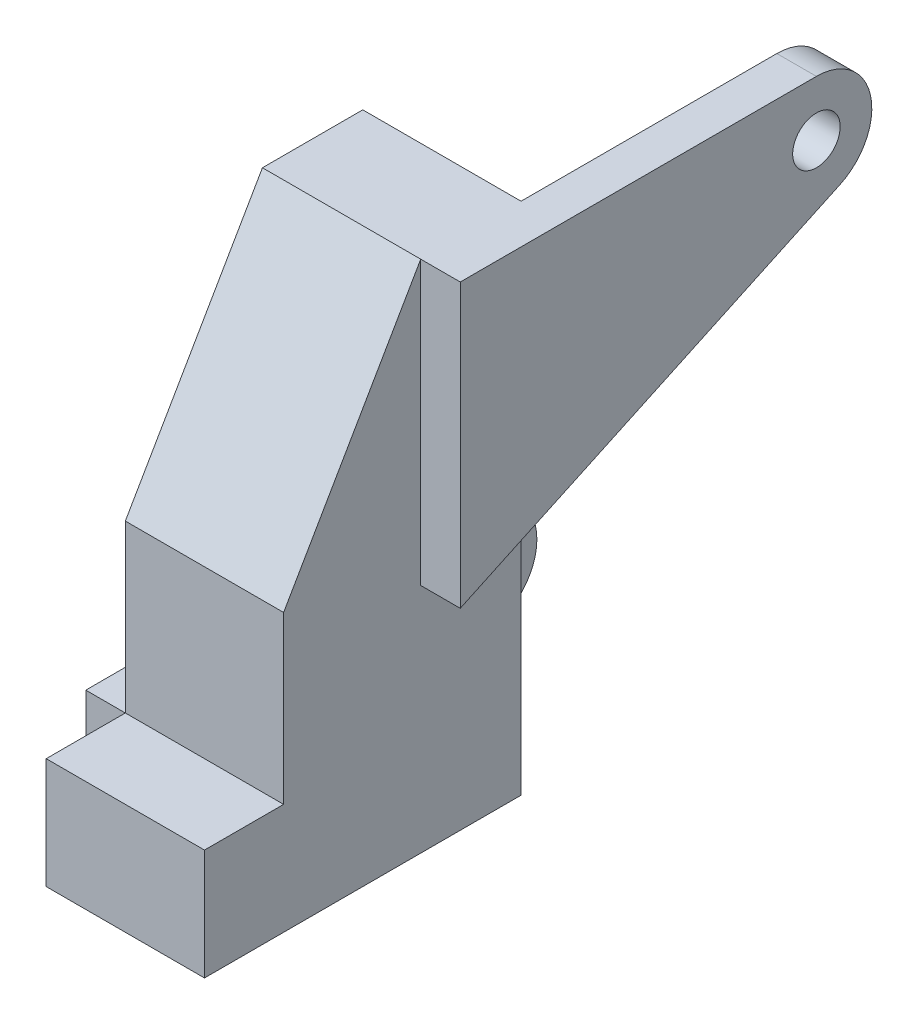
SolidWorks part; units mm, degrees
ref_plane "Front Plane" through (0, 0, 0) normal (0, 0, 1) x (1, 0, 0)
ref_plane "Top Plane" through (0, 0, 0) normal (0, 1, 0) x (1, 0, 0)
ref_plane "Right Plane" through (0, 0, 0) normal (1, 0, 0) x (0, 0, -1)
sketch "Sketch5" plane through (0, 0, 0) normal (1, 0, 0) x (0, 0, -1)
  line L0 (0, 0) -> (0, 14)
  line L1 (0, 14) -> (10, 14)
  line L2 (10, 14) -> (10, 35)
  line L3 (10, 35) -> (27.3205, 65)
  line L4 (27.3205, 65) -> (40, 65)
  line L5 (40, 65) -> (40, 0)
  line L6 (40, 0) -> (0, 0)
  line L7 (10, 35) -> (10, 75.7249) construction
  dimension "D1" = 40
  dimension "D2" = 35
  dimension "D3" = 10
  dimension "D4" = 65
  dimension "D5" = 14
  dimension "D6" = 30
extrude "Boss-Extrude3" add sketch "Sketch5" along normal blind 20
sketch "Sketch6" plane through (20, 0, 0) normal (1, 0, 0) x (0, 0, -1)
  line L0 (27.3205, 65) -> (27.3205, 29.2925)
  line L1 (27.3205, 29.2925) -> (75.2788, 51.6558)
  line L3 (72.3205, 65) -> (27.3205, 65)
  arc A0 (72.3205, 65) -> (75.2788, 51.6558) centre (72.3205, 58) cw
  circle A1 centre (72.3205, 58) radius 3
  dimension "D1" = 7
  dimension "D4" = 6
  dimension "D2" = 45
  dimension "D3" = 65
extrude "Boss-Extrude4" add sketch "Sketch6" along normal blind 5
sketch "Sketch7" plane through (0, 0, 0) normal (-1, 0, 0) x (0, 0, 1)
  line L1 (-10, 14) -> (-55, 14)
  line L3 (-55, 0) -> (-10, 0)
  line L4 (-40, 0) -> (-40, 65) construction
  line L5 (-10, 14) -> (-10, 0)
  arc A0 (-55, 14) -> (-55, 0) centre (-55, 7) ccw
  circle A1 centre (-55, 7) radius 3.5
  dimension "D1" = 7
  dimension "D3" = 7
  dimension "D2" = 15
extrude "Boss-Extrude5" add sketch "Sketch7" along normal blind 5
